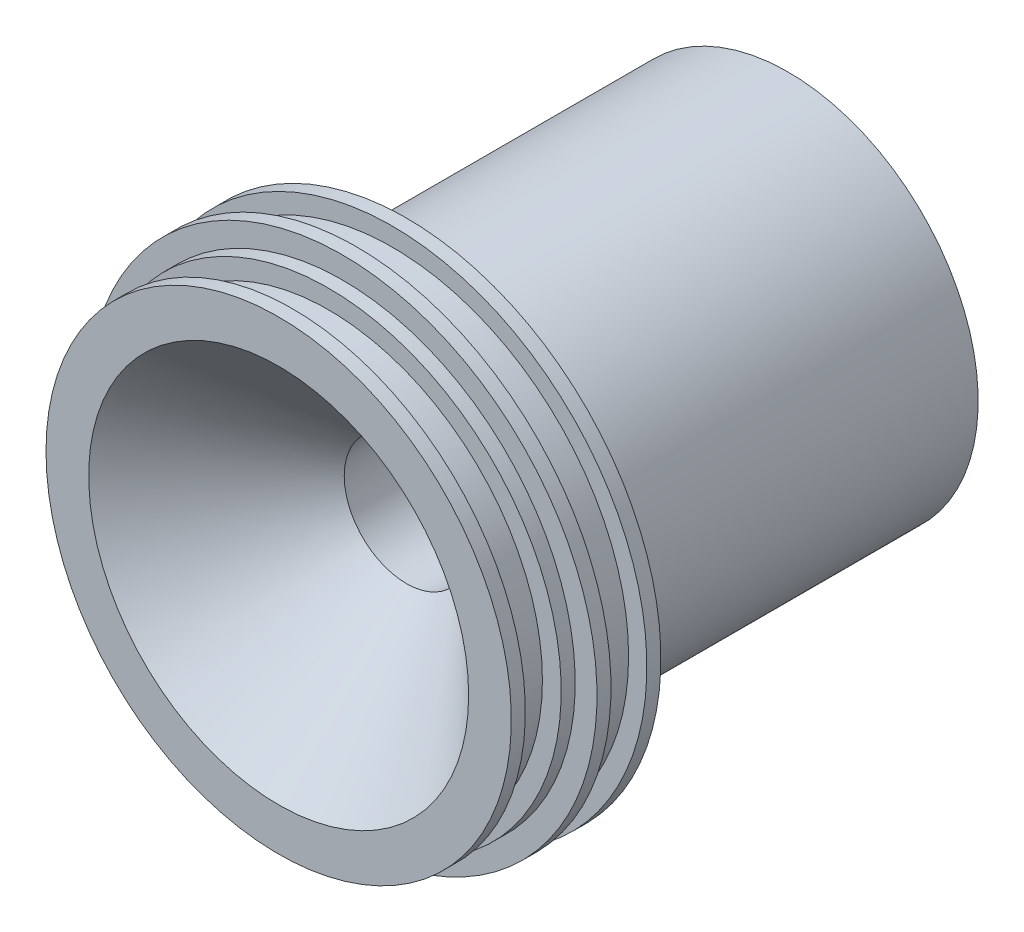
SolidWorks part; units mm, degrees
ref_plane "Front Plane" through (0, 0, 0) normal (1, 0, 0) x (0, 1, 0)
ref_plane "Top Plane" through (0, 0, 0) normal (0, 0, 1) x (0, 1, 0)
ref_plane "Right Plane" through (0, 0, 0) normal (0, 1, 0) x (-1, 0, 0)
sketch "Sketch1" plane through (0, 0, 0) normal (1, 0, 0) x (0, 1, 0)
  line L0 (9.2535, 7.2669) -> (28.2575, 26.271)
  line L1 (0, -87.4649) -> (0, 25.89) construction
  line L2 (9.2535, 7.2669) -> (9.2535, -7.2669)
  line L3 (0, 25.89) -> (28.2575, 25.89) construction
  line L4 (9.2535, 40.227) -> (9.2535, -25.6932) construction
  line L5 (9.2535, -7.2669) -> (20.574, -49.5157)
  line L6 (20.574, -49.5157) -> (28.2575, -49.5157)
  line L7 (28.2575, -49.5157) -> (28.2575, 7.2669)
  line L8 (28.2575, 7.2669) -> (37.846, 7.2669)
  line L10 (37.846, 16.769) -> (34.6075, 16.769)
  line L12 (34.6075, 26.271) -> (28.2575, 26.271)
  line L13 (0.2515, 7.2669) -> (37.846, 7.2669) construction
  line L14 (37.846, 16.769) -> (37.846, 14.6849)
  line L15 (37.846, 14.6849) -> (35.1282, 14.6849)
  line L16 (35.1282, 14.6849) -> (35.1282, 9.3509)
  line L17 (35.1282, 9.3509) -> (37.846, 9.3509)
  line L18 (37.846, 9.3509) -> (37.846, 7.2669)
  line L19 (37.846, 9.3509) -> (37.846, 14.6849) construction
  line L20 (34.6075, 26.271) -> (34.6075, 24.187)
  line L21 (34.6075, 24.187) -> (31.8135, 24.187)
  line L22 (31.8135, 24.187) -> (31.8135, 18.853)
  line L23 (31.8135, 18.853) -> (34.6075, 18.853)
  line L24 (34.6075, 18.853) -> (34.6075, 16.769)
  line L25 (28.2575, 26.271) -> (28.2575, 7.2669) construction
  line L26 (34.6075, 16.769) -> (34.6075, 26.271) construction
  point P3 (9.2535, 7.2669)
  point P17 (37.846, 12.0179)
  point P18 (34.6075, 21.52)
  point P23 (35.1282, 12.0179)
  point P24 (31.8135, 21.52)
  point P29 (0, 0)
  point P30 (9.2535, 0)
  point P31 (28.2575, 7.2669)
revolve "Revolve1" add sketch "Sketch1" angle 360 about L1
ref_plane "Plane1" through (37.592, 0, 0) normal (1, 0, 0) x (0, 1, 0)
equation "\"TL\"=0.5722"
equation "\"D9@Sketch1\"=\"TL\""
equation "\"NR\"= \"TL\""
